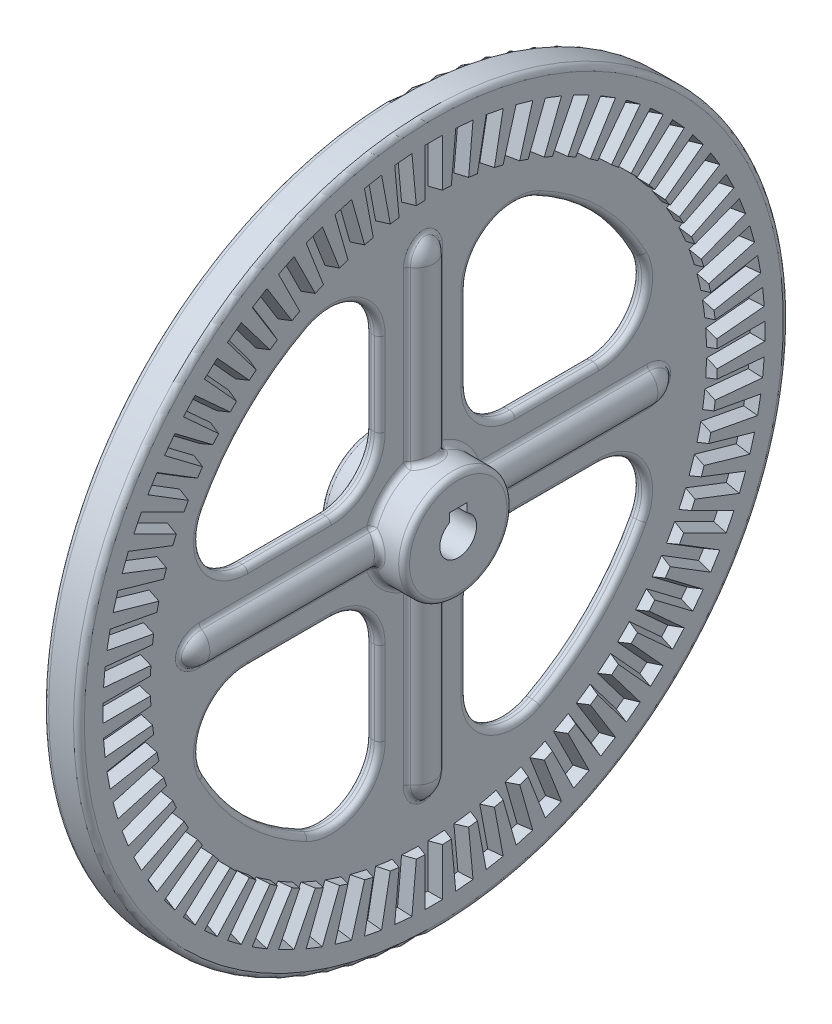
SolidWorks part; units mm, degrees
ref_plane "Front Plane" through (0, 0, 0) normal (0, 0, 1) x (1, 0, 0)
ref_plane "Top Plane" through (0, 0, 0) normal (0, 1, 0) x (1, 0, 0)
ref_plane "Right Plane" through (0, 0, 0) normal (1, 0, 0) x (0, 0, -1)
sketch "Sketch1" plane through (0, 0, 0) normal (0, 0, 1) x (1, 0, 0)
  line L0 (0, 0) -> (0, 156.1923) construction
  line L1 (4.953, 96.343) -> (4.953, 92.152)
  line L2 (-5.8928, 89.993) -> (5.08, 89.993) construction
  line L3 (2.0955, 123.2512) -> (0.8255, 123.2512)
  line L4 (0.8255, 123.2512) -> (0.8255, 96.343)
  line L5 (4.953, 96.343) -> (0.8255, 96.343)
  line L6 (2.0955, 123.2512) -> (2.0955, 131.6332)
  line L7 (2.0955, 131.6332) -> (-2.0955, 131.6332)
  line L8 (-0.8255, 123.2512) -> (-0.8255, 96.343)
  line L9 (-2.0955, 123.2512) -> (-0.8255, 123.2512)
  line L11 (4.953, 92.152) -> (-4.953, 92.152)
  line L13 (-4.953, 96.343) -> (-4.953, 92.152)
  line L14 (-4.953, 96.343) -> (-0.8255, 96.343)
  line L15 (-2.0955, 123.2512) -> (-2.0955, 131.6332)
  point P12 (0, 131.6332)
  dimension "D1" = 83.2804
  dimension "D2" = 4.318
  dimension "D3" = 12.7
  dimension "D4" = 9.906
  dimension "D5" = 4.191
  dimension "D6" = 89.993
  dimension "D7" = 8.382
  dimension "D8" = 1.27
revolve "Revolve1" add sketch "Sketch1" angle 360 about L2
sketch "Sketch2" plane through (2.0955, 0, 0) normal (1, 0, 0) x (0, 0, -1)
  line L0 (10.795, 95.073) -> (20.5818, 95.073)
  line L1 (5.08, 110.5748) -> (5.08, 100.788)
  line L2 (-5.08, 100.788) -> (-5.08, 110.5748)
  line L3 (5.08, 79.198) -> (5.08, 69.4111)
  line L4 (20.5818, 84.913) -> (10.795, 84.913)
  line L5 (-20.5818, 95.073) -> (-10.795, 95.073)
  line L6 (-10.795, 84.913) -> (-20.5818, 84.913)
  line L7 (-5.08, 69.4111) -> (-5.08, 79.198)
  arc A1 (-13.4495, 115.6359) -> (-25.6429, 103.4425) centre (0, 89.993) ccw
  arc A2 (-5.08, 110.5748) -> (-13.4495, 115.6359) centre (-10.795, 110.5748) ccw
  arc A3 (-20.5818, 95.073) -> (-25.6429, 103.4425) centre (-20.5818, 100.788) cw
  arc A4 (-5.08, 100.788) -> (-10.795, 95.073) centre (-10.795, 100.788) cw
  arc A5 (25.6429, 103.4425) -> (13.4495, 115.6359) centre (0, 89.993) ccw
  arc A6 (20.5818, 95.073) -> (25.6429, 103.4425) centre (20.5818, 100.788) ccw
  arc A7 (5.08, 110.5748) -> (13.4495, 115.6359) centre (10.795, 110.5748) cw
  arc A8 (10.795, 95.073) -> (5.08, 100.788) centre (10.795, 100.788) cw
  arc A9 (13.4495, 64.35) -> (25.6429, 76.5434) centre (0, 89.993) ccw
  arc A10 (5.08, 69.4111) -> (13.4495, 64.35) centre (10.795, 69.4111) ccw
  arc A11 (20.5818, 84.913) -> (25.6429, 76.5434) centre (20.5818, 79.198) cw
  arc A12 (5.08, 79.198) -> (10.795, 84.913) centre (10.795, 79.198) cw
  arc A13 (-25.6429, 76.5434) -> (-13.4495, 64.35) centre (0, 89.993) ccw
  arc A14 (-20.5818, 84.913) -> (-25.6429, 76.5434) centre (-20.5818, 79.198) ccw
  arc A15 (-5.08, 69.4111) -> (-13.4495, 64.35) centre (-10.795, 69.4111) cw
  arc A16 (-10.795, 84.913) -> (-5.08, 79.198) centre (-10.795, 79.198) cw
  dimension "D3" = 28.956
  dimension "D4" = 5.715
  dimension "D1" = 5.08
  dimension "D2" = 5.08
extrude "Cut-Extrude1" cut sketch "Sketch2" against normal up to next
sketch "Sketch3" plane through (0, 0, 0) normal (0, 0, 1) x (1, 0, 0)
  line L0 (0, 89.993) -> (0, 134.7084) construction
  line L1 (2.0955, 116.2693) -> (2.0955, 93.345)
  line L2 (2.0955, 48.3527) -> (2.0955, 131.6332) construction
  line L3 (0.8255, 118.745) -> (0.8255, 93.345)
  line L4 (0.8255, 93.345) -> (2.0955, 93.345)
  line L5 (0.8255, 56.7347) -> (0.8255, 123.2512) construction
  line L6 (-2.4934, 89.993) -> (4.953, 89.993) construction
  line L7 (0.8255, 86.6409) -> (2.0955, 86.6409)
  line L8 (0.8255, 61.2409) -> (0.8255, 86.6409)
  line L9 (2.0955, 63.7166) -> (2.0955, 86.6409)
  line L10 (4.953, 87.834) -> (4.953, 92.152) construction
  line L11 (-5.8928, 89.993) -> (5.08, 89.993) construction
  arc A0 (2.0955, 116.2693) -> (0.8255, 118.745) centre (-0.9525, 116.2693) ccw
  arc A1 (2.0955, 63.7166) -> (0.8255, 61.2409) centre (-0.9525, 63.7166) cw
  dimension "D2" = 3.048
  dimension "D1" = 25.4
  dimension "D3" = 93.345
revolve "Revolve2" add sketch "Sketch3" angle 360 about L0
pattern_circular "CirPattern1" count 2 over 90 about axis through (-5.8928, 89.993, 0) along (1, 0, 0) of "Revolve2"
sketch "Sketch4" plane through (-2.0955, 0, 0) normal (-1, 0, 0) x (0, 0, 1)
  line L0 (0, 89.993) -> (0, 133.9327) construction
  line L1 (1.016, 122.4733) -> (1.016, 128.8233)
  line L2 (-1.016, 122.4733) -> (-1.016, 128.8233)
  line L3 (-1.016, 128.8233) -> (1.016, 128.8233)
  circle A3 centre (0, 89.993) radius 32.4962
  arc A4 (1.016, 122.4733) -> (-1.016, 122.4733) centre (0, 89.993) ccw
  dimension "D1" = 6.35
  dimension "D2" = 2.032
  dimension "D3" = 0.762
extrude "Cut-Extrude2" cut sketch "Sketch4" against normal blind 1.27 draft 20
pattern_circular "CirPattern2" count 68 over 360 about axis through (0, 89.993, 0) along (1, 0, 0) of "Cut-Extrude2"
mirror "Mirror5" about plane through (0, 0, 0) normal (1, 0, 0) of "CirPattern2", "Cut-Extrude2"
fillet "Fillet1" radius 0.635 92 edges at (-2.0955, 89.993, 41.6402) (2.0955, 89.993, 41.6402) (-0.8255, 83.2391, 6.7539) (-0.8255, 84.913, 15.6884) (-0.8255, 82.1552, 25.4722) (-0.8255, 69.518, 20.475) (-0.8255, 64.5207, 7.8377) (0.8255, 64.5207, 7.8377) (0.8255, 69.518, 20.475) (0.8255, 82.1552, 25.4722) (0.8255, 84.913, 15.6884) (0.8255, 83.2391, 6.7539) (-0.8255, 82.1552, -25.4722) (-0.8255, 84.913, -15.6884) (-0.8255, 83.2391, -6.7539) (-0.8255, 74.3045, -5.08) (-0.8255, 64.5207, -7.8377) (0.8255, 82.1552, -25.4722) (0.8255, 69.518, -20.475) (0.8255, 64.5207, -7.8377) (0.8255, 74.3045, -5.08) (0.8255, 83.2391, -6.7539) (-0.8255, 115.4652, -7.8377) (-0.8255, 105.6814, -5.08) (-0.8255, 96.7468, -6.7539) (-0.8255, 95.073, -15.6884) (-0.8255, 97.8307, -25.4722) (0.8255, 115.4652, -7.8377) (0.8255, 110.4679, -20.475) (0.8255, 97.8307, -25.4722) (0.8255, 95.073, -15.6884) (0.8255, 96.7468, -6.7539) (-0.8255, 115.4652, 7.8377) (-0.8255, 110.4679, 20.475) (-0.8255, 97.8307, 25.4722) (-0.8255, 95.073, 15.6884) (-0.8255, 96.7468, 6.7539) (0.8255, 96.7468, 6.7539) (0.8255, 95.073, 15.6884) (0.8255, 97.8307, 25.4722) (0.8255, 110.4679, 20.475) (0.8255, 115.4652, 7.8377) (-0.8255, 74.3045, 5.08) (0.8255, 74.3045, 5.08) (-0.8255, 69.518, -20.475) (0.8255, 84.913, -15.6884) (-0.8255, 110.4679, -20.475) (0.8255, 105.6814, -5.08) (-0.8255, 105.6814, 5.08) (0.8255, 105.6814, 5.08) (-0.8255, 73.8293, 1.9261) (-0.8255, 73.8293, -1.9261) (-0.8255, 66.1847, 0.1319) (-0.8255, 88.0669, -16.1636) (-0.8255, 91.919, -16.1636) (-0.8255, 89.861, -23.8082) (-0.8255, 106.1566, -1.9261) (-0.8255, 106.1566, 1.9261) (-0.8255, 113.8012, -0.1319) (-0.8255, 91.919, 16.1636) (-0.8255, 88.0669, 16.1636) (-0.8255, 90.1249, 23.8082) (0.8255, 91.919, -16.1636) (0.8255, 88.0669, -16.1636) (0.8255, 90.1249, -23.8082) (0.8255, 106.1566, 1.9261) (0.8255, 106.1566, -1.9261) (0.8255, 113.8012, 0.1319) (0.8255, 88.0669, 16.1636) (0.8255, 91.919, 16.1636) (0.8255, 89.861, 23.8082) (0.8255, 73.8293, -1.9261) (0.8255, 73.8293, 1.9261) (0.8255, 66.1847, -0.1319) (-2.074, 96.3359, 0.2991) (-0.8255, 94.4831, 4.4901) (-2.0693, 89.6627, 6.3414) (-0.8255, 85.5028, 4.4901) (-2.0335, 83.6632, -0.5061) (-0.8255, 85.5028, -4.4901) (-2.0335, 90.4991, -6.3298) (-0.8255, 94.4831, -4.4901) (-4.953, 89.993, 6.35) (4.953, 89.993, 6.35) (2.0899, 83.6448, 0.1537) (0.8255, 85.5028, 4.4901) (-2.0693, 89.6627, 6.3414) (0.8255, 94.4831, 4.4901) (2.074, 96.3359, -0.2991) (0.8255, 94.4831, -4.4901) (2.0899, 89.8392, -6.3481) (0.8255, 85.5028, -4.4901)
sketch "Sketch5" plane through (4.953, 0, 0) normal (1, 0, 0) x (0, 0, -1)
  line L0 (0, 92.152) -> (0, 93.676) construction
  line L1 (1.016, 92.914) -> (-1.016, 92.914)
  line L2 (-1.016, 92.914) -> (-1.016, 91.898)
  line L3 (1.016, 92.914) -> (1.016, 91.898)
  circle A0 centre (0, 89.993) radius 2.159 construction
  circle A1 centre (0, 89.993) radius 2.159
  point P9 (0, 92.914)
  dimension "D1" = 2.032
  dimension "D2" = 0.762
extrude "Cut-Extrude3" cut sketch "Sketch5" against normal through all
